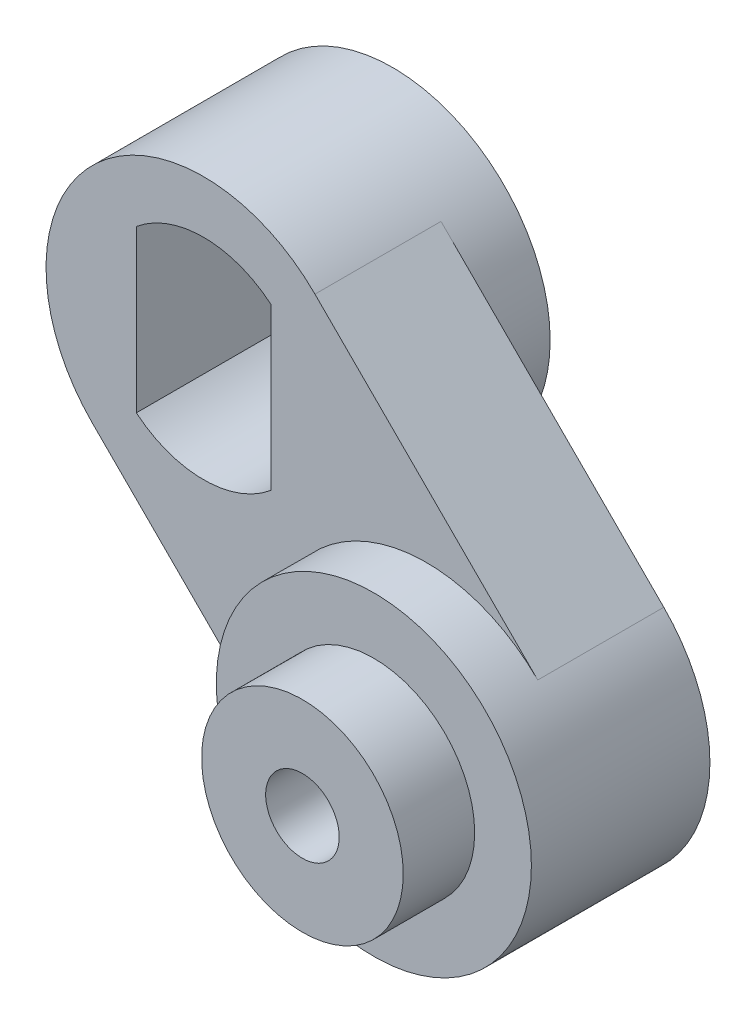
SolidWorks part; units mm, degrees
ref_plane "Plan de face" through (0, 0, 0) normal (0, 0, 1) x (1, 0, 0)
ref_plane "Plan de dessus" through (0, 0, 0) normal (0, 1, 0) x (1, 0, 0)
ref_plane "Plan de droite" through (0, 0, 0) normal (1, 0, 0) x (0, 0, -1)
sketch "Esquisse1" plane through (0, 0, 0) normal (0, 0, 1) x (1, 0, 0)
  line L0 (0, 0) -> (3.2, 0) construction
  line L1 (0, 0) -> (-3.2, 0) construction
  line L2 (-3.2, 0) -> (-3.2, 3.8419)
  line L3 (-3.2, 0) -> (-3.2, -3.8419)
  line L4 (3.2, 0) -> (3.2, -3.8419)
  line L5 (3.2, 0) -> (3.2, 3.8419)
  circle A0 centre (0, 0) radius 7.5
  arc A1 (-3.2, -3.8419) -> (3.2, -3.8419) centre (0, 0) ccw
  arc A2 (3.2, 3.8419) -> (-3.2, 3.8419) centre (0, 0) ccw
  dimension "D1" = 15
  dimension "D2" = 10
  dimension "D3" = 3.2
  dimension "D4" = 3.2
extrude "Boss.-Extru.1" add sketch "Esquisse1" along normal blind 9
sketch "Esquisse2" plane through (0, 0, 9) normal (0, 0, 1) x (1, 0, 0)
  line L0 (0, 0) -> (10.6066, -10.6066)
  line L3 (0, 0) -> (10.7025, 0) construction
  line L4 (15.9099, -5.3033) -> (5.3033, 5.3033)
  line L5 (5.3033, -15.9099) -> (-5.3033, -5.3033)
  line L6 (10.6066, -10.6066) -> (16.4023, -4.8109) construction
  line L7 (10.6066, -10.6066) -> (4.1794, -17.0338) construction
  arc A0 (5.3033, -15.9099) -> (15.9099, -5.3033) centre (10.6066, -10.6066) ccw
  arc A2 (5.3033, 5.3033) -> (-5.3033, -5.3033) centre (0, 0) ccw
  dimension "D2" = 15
  dimension "D1" = 15
  dimension "D3" = 45
  dimension "D4" = 15
  dimension "D5" = 15
extrude "Boss.-Extru.2" add sketch "Esquisse2" against normal blind 6
sketch "Esquisse3" plane through (0, 0, 9) normal (0, 0, 1) x (1, 0, 0)
  circle A1 centre (10.6066, -10.6066) radius 7.5
  dimension "D1" = 15
extrude "Boss.-Extru.3" add sketch "Esquisse3" along normal blind 2.5
sketch "Esquisse4" plane through (0, 0, 11.5) normal (0, 0, 1) x (1, 0, 0)
  circle A0 centre (10.6066, -10.6066) radius 4.8
  dimension "D1" = 9.6
extrude "Boss.-Extru.4" add sketch "Esquisse4" along normal blind 3.4
sketch "Esquisse5" plane through (0, 0, 14.9) normal (0, 0, 1) x (1, 0, 0)
  circle A0 centre (10.6066, -10.6066) radius 1.75
  dimension "D1" = 3.5
extrude "Enlèv. mat.-Extru.1" cut sketch "Esquisse5" against normal blind 19.4
